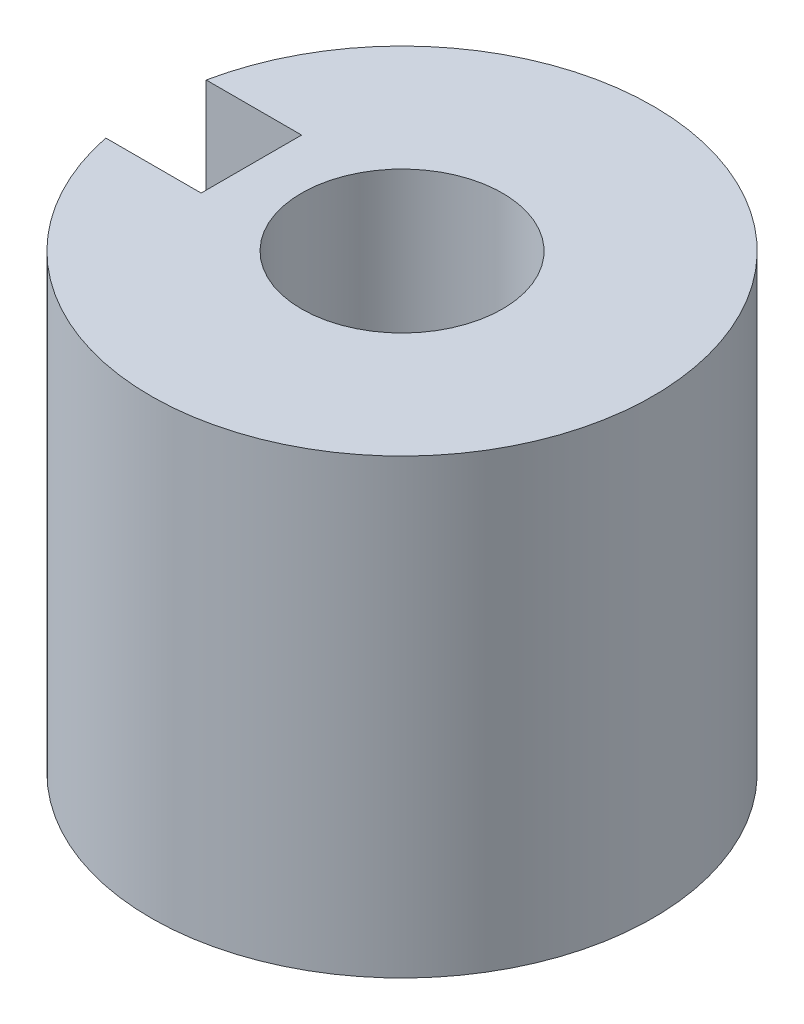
SolidWorks part; units mm, degrees
ref_plane "Front Plane" through (0, 0, 0) normal (0, 0, 1) x (1, 0, 0)
ref_plane "Top Plane" through (0, 0, 0) normal (0, 1, 0) x (1, 0, 0)
ref_plane "Right Plane" through (0, 0, 0) normal (1, 0, 0) x (0, 0, -1)
sketch "Sketch1" plane through (0, 0, 0) normal (0, 1, 0) x (1, 0, 0)
  circle A0 centre (2.5, 0) radius 2.5
  circle A1 centre (2.5, 0) radius 1
  dimension "D1" = 2
  dimension "D2" = 5
extrude "Boss-Extrude1" add sketch "Sketch1" along normal blind 4.5
sketch "Sketch2" plane through (0, 0, 0) normal (1, 0, 0) x (0, 0, -1)
  line L0 (2.5, 4.5) -> (-2.5, 4.5) construction
  line L1 (0.5, 0) -> (-0.5, 0)
  line L2 (0.5, 0) -> (0.5, 1.5)
  line L3 (0.5, 1.5) -> (-0.5, 1.5)
  line L4 (-0.5, 0) -> (-0.5, 1.5)
  line L5 (0.5, 0) -> (-0.5, 1.5) construction
  line L6 (0.5, 1.5) -> (-0.5, 0) construction
  line L7 (0.5, 3) -> (-0.5, 3)
  line L8 (0.5, 3) -> (0.5, 4.5)
  line L9 (0.5, 4.5) -> (-0.5, 4.5)
  line L10 (-0.5, 3) -> (-0.5, 4.5)
  line L11 (0.5, 3) -> (-0.5, 4.5) construction
  line L12 (0.5, 4.5) -> (-0.5, 3) construction
  point P0 (0, 0.75)
  point P5 (0, 3.75)
  dimension "D1" = 1.5
  dimension "D2" = 1
  dimension "D3" = 1.5
extrude "Cut-Extrude1" cut sketch "Sketch2" along normal blind 1
